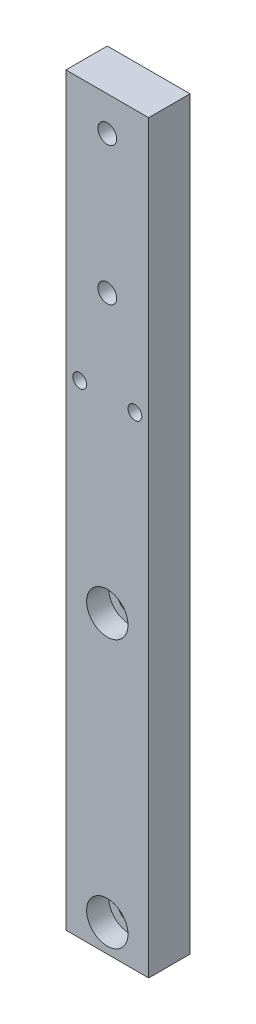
SolidWorks part; units mm, degrees
ref_plane "Plan de face" through (0, 0, 0) normal (0, 0, 1) x (1, 0, 0)
ref_plane "Plan de dessus" through (0, 0, 0) normal (0, 1, 0) x (1, 0, 0)
ref_plane "Plan de droite" through (0, 0, 0) normal (1, 0, 0) x (0, 0, -1)
sketch "Esquisse1" plane through (0, 0, 0) normal (0, 1, 0) x (1, 0, 0)
  line L1 (-15, 0) -> (15, 0)
  line L2 (-15, 0) -> (-15, 15)
  line L3 (-15, 15) -> (15, 15)
  line L4 (15, 0) -> (15, 15)
  dimension "D1" = 15
  dimension "D2" = 30
extrude "Extrusion1" add sketch "Esquisse1" along normal blind 270
hole_wizard "Chambrage pour axes 8.5 mm1" positions "Esquisse3" profile "Esquisse2" counterbore size "8.5" standard "HASCO Métrique"
sketch "Esquisse3" plane through (0, 0, 0) normal (0, 0, 1) x (1, 0, 0)
  line L0 (-15, 0) -> (15, 0) construction
  point P0 (0, 107)
  point P1 (0, 10)
  dimension "D1" = 97
  dimension "D2" = 10
sketch "Esquisse2" plane through (0, 107, 0) normal (1, 0, 0) x (0, -1, 0)
  line L0 (0, 0) -> (0, 15)
  line L1 (0, 15) -> (4.25, 15)
  line L3 (4.25, 15) -> (4.25, 8)
  line L4 (4.25, 8) -> (7.5, 8)
  line L5 (7.5, 8) -> (7.5, 0)
  line L7 (7.5, 0) -> (0, 0)
  line L11 (0, -6.35) -> (0, 107.95) construction
  dimension "Diamètre du perçage jusqu'au prochain" = 8.5
  dimension "Profondeur du perçage jusqu'au prochain" = 15
  dimension "Diamètre du chambrage" = 15
  dimension "Profondeur du chambrage" = 8
hole_wizard "Trou taraudé M81" positions "Esquisse5" profile "Esquisse4" tap size "M8" standard "ISO"
sketch "Esquisse5" plane through (0, 0, 0) normal (0, 0, 1) x (1, 0, 0)
  line L0 (-15, 270) -> (15, 270) construction
  point P0 (0, 257.5)
  point P1 (0, 207.5)
  dimension "D1" = 50
  dimension "D2" = 12.5
sketch "Esquisse4" plane through (0, 257.5, 0) normal (1, 0, 0) x (0, -1, 0)
  line L0 (0, 0) -> (0, 15)
  line L1 (0, 15) -> (3.4, 15)
  line L2 (3.4, 15) -> (3.4, 0)
  line L5 (3.4, 0) -> (0, 0)
  line L11 (0, -6.35) -> (0, 107.95) construction
  dimension "Diamètre du trou pour taraudage jusqu'au prochain" = 6.8
  dimension "Profondeur du trou pour taraudage jusqu'au prochain" = 15
hole_wizard "Trou taraudé M61" positions "Esquisse7" profile "Esquisse6" tap size "M6" standard "ISO"
sketch "Esquisse7" plane through (0, 0, 0) normal (0, 0, 1) x (1, 0, 0)
  line L0 (-15, 0) -> (15, 0) construction
  line L2 (-15, 270) -> (-15, 0) construction
  point P0 (-10, 175)
  point P1 (10, 175)
  dimension "D1" = 175
  dimension "D2" = 20
  dimension "D3" = 5
sketch "Esquisse6" plane through (-10, 175, 0) normal (1, 0, 0) x (0, -1, 0)
  line L0 (0, 0) -> (0, 15)
  line L1 (0, 15) -> (2.5, 15)
  line L2 (2.5, 15) -> (2.5, 0)
  line L5 (2.5, 0) -> (0, 0)
  line L11 (0, -6.35) -> (0, 107.95) construction
  dimension "Diamètre du trou pour taraudage jusqu'au prochain" = 5
  dimension "Profondeur du trou pour taraudage jusqu'au prochain" = 15
